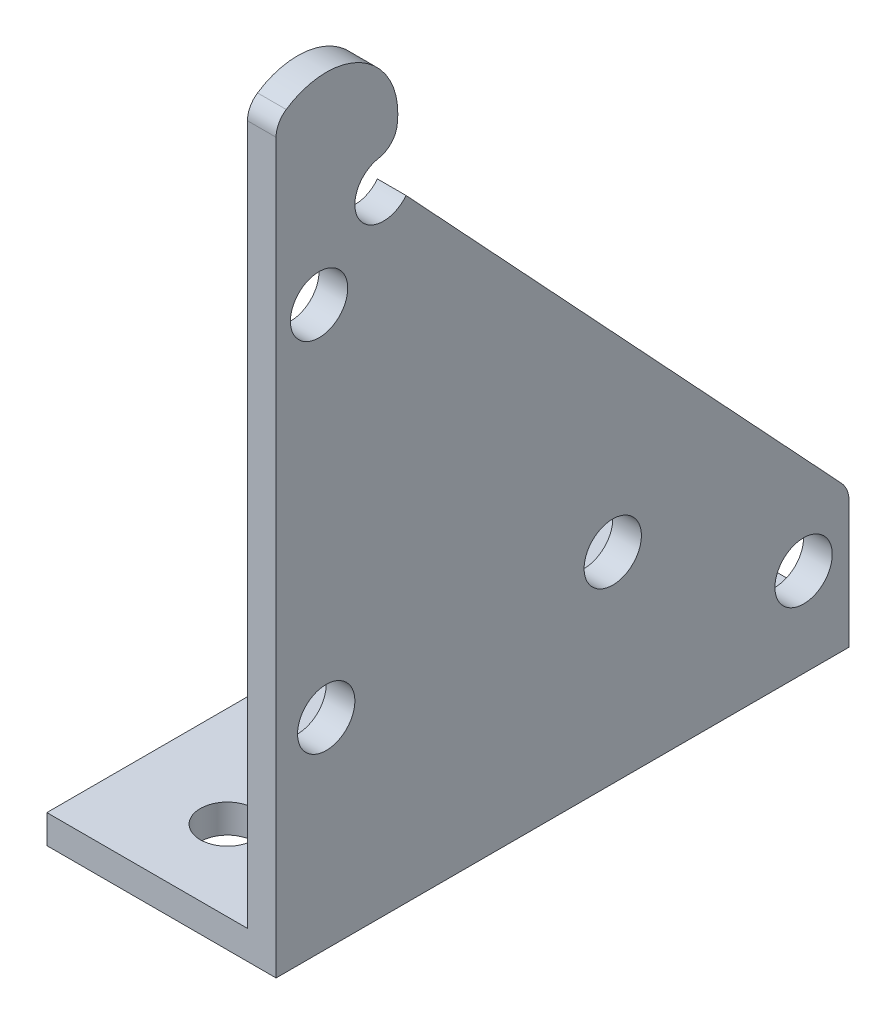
SolidWorks part; units mm, degrees
ref_plane "Front Plane" through (0, 0, 0) normal (0, 0, 1) x (1, 0, 0)
ref_plane "Top Plane" through (0, 0, 0) normal (0, 1, 0) x (1, 0, 0)
ref_plane "Right Plane" through (0, 0, 0) normal (1, 0, 0) x (0, 0, -1)
sketch "Sketch1" plane through (0, 0, 0) normal (1, 0, 0) x (0, 0, -1)
  line L0 (63.5, 0) -> (0, 0)
  line L2 (63.5, 0) -> (63.5, 15.24)
  line L3 (63.5, 15.24) -> (14.4029, 67.8902)
  line L4 (0, 0) -> (0, 80.6769)
  arc A0 (14.4029, 67.8902) -> (11.3488, 72.9759) centre (11.905, 69.85) cw
  arc A1 (1.1212, 82.7837) -> (13.4209, 75.1362) centre (5.555, 76.2) cw
  arc A2 (1.1212, 82.7837) -> (0, 80.6769) centre (2.54, 80.6769) ccw
  arc A3 (13.4209, 75.1362) -> (11.3488, 72.9759) centre (10.9038, 75.4766) cw
  point P15 (37.305, 22.225)
  point P16 (58.4518, 9.8425)
  point P17 (4.7625, 62.23)
  dimension "D5" = 2.54
  dimension "D6" = 7.9375
  dimension "D7" = 2.54
  dimension "D8" = 3.175
  dimension "D12" = 13.97
  dimension "D1" = 63.5
  dimension "D2" = 5.0482
  dimension "D3" = 4.7625
  dimension "D4" = 43
  dimension "D9" = 22.225
  dimension "D10" = 62.23
  dimension "D11" = 37.305
  dimension "D13" = 6.35
  dimension "D14" = 6.35
  dimension "D15" = 5.555
  dimension "D16" = 9.8425
  dimension "D17" = 15.24
extrude "Extrude1" add sketch "Sketch1" along normal blind 3.175
sketch "Sketch2" plane through (0, 0, 0) normal (0, 0, 1) x (1, 0, 0)
  line L0 (-22.225, 0) -> (3.175, 0)
  line L1 (3.175, 0) -> (3.175, 3.175)
  line L2 (3.175, 3.175) -> (-22.225, 3.175)
  line L4 (-22.225, 3.175) -> (-22.225, 0)
  dimension "D1" = 3.175
  dimension "D2" = 25.4
extrude "Extrude2" add sketch "Sketch2" against normal up to vertex
fillet "Fillet1" radius 3.175 1 edges at (1.5875, 15.24, -63.5)
sketch "Sketch4" plane through (0, 3.175, 0) normal (0, 1, 0) x (-1, 0, 0)
  line L0 (11.1125, -63.5) -> (11.1125, 0) construction
  line L1 (0, -63.5) -> (22.225, -63.5) construction
  line L2 (0, 0) -> (22.225, 0) construction
  line L3 (11.1125, -31.75) -> (9.525, -31.75) construction
  point P6 (11.1125, -9.525)
  point P7 (11.1125, -53.975)
  point P8 (9.525, -31.75)
  dimension "D1" = 9.525
  dimension "D2" = 3.175
other "Hole1" parameters "D1"=6.35
sketch "Sketch3" plane through (0, 0, 0) normal (-1, 0, 0) x (0, 0, 1)
  circle A0 centre (-5.555, 22.225) radius 3.175
  dimension "D1" = 6.35
pattern_sketch "Sketch-Pattern1" of "Hole1"
hole_wizard "Ø6.0 (6) Diameter Hole1" positions "Sketch6" profile "Sketch5" hole size "Ø6.0" standard "Ansi Metric"
sketch "Sketch6" plane through (0, 3.175, 0) normal (0, 1, 0) x (-1, 0, 0)
  line L0 (11.1125, -63.5) -> (11.1125, 0) construction
  line L1 (0, -63.5) -> (22.225, -63.5) construction
  line L2 (0, 0) -> (22.225, 0) construction
  line L3 (11.1125, -31.75) -> (22.225, -31.75) construction
  line L4 (22.225, -63.5) -> (22.225, 0) construction
  point P0 (11.1125, -54.61)
  point P1 (11.1125, -31.75)
  point P3 (11.1125, -8.89)
  dimension "D1" = 22.86
sketch "Sketch5" plane through (-11.1125, 3.175, -54.61) normal (1, 0, 0) x (0, 0, 1)
  line L0 (0, 0) -> (0, 22.1226)
  line L1 (0, 22.1226) -> (3, 20.32)
  line L2 (3, 20.32) -> (3, 0)
  line L5 (3, 0) -> (0, 0)
  line L10 (0, 22.1226) -> (-3, 20.32) construction
  line L11 (0, -6.35) -> (0, 107.95) construction
  dimension "Hole Dia." = 6
  dimension "Hole Depth" = 20.32
  dimension "Drill Angle" = 118
